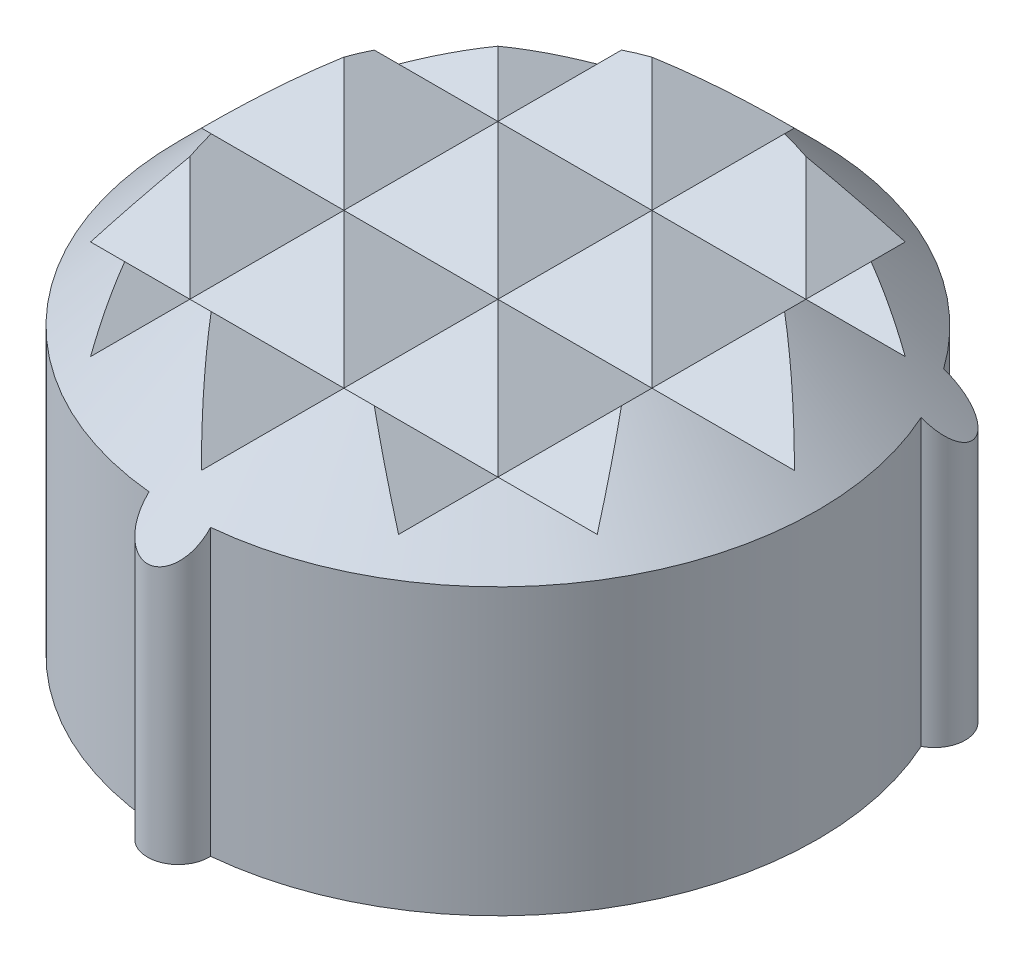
SolidWorks part; units mm, degrees
ref_plane "Front Plane" through (0, 0, 0) normal (0, 0, 1) x (1, 0, 0)
ref_plane "Top Plane" through (0, 0, 0) normal (0, 1, 0) x (1, 0, 0)
ref_plane "Right Plane" through (0, 0, 0) normal (1, 0, 0) x (0, 0, -1)
sketch "Sketch1" plane through (0, 0, 0) normal (0, 0, 1) x (1, 0, 0)
  line L0 (0, 0) -> (0, -66.2626) construction
  line L1 (0, 0) -> (4.55, 0)
  line L2 (4.55, 0) -> (4.55, 5)
  line L4 (4.55, 5) -> (0, 5)
  line L5 (0, 5) -> (0, 0)
  dimension "D1" = 5
  dimension "D2" = 9.1
revolve "Revolve1" add sketch "Sketch1" angle 360 about L0
sketch "Sketch2" plane through (0, 0, 0) normal (0, 1, 0) x (1, 0, 0)
  line L0 (0, 0) -> (0, -5.5148) construction
  line L1 (0, 0) -> (-5.4284, 3.1341) construction
  line L2 (0, 0) -> (5.592, 3.2286) construction
  arc A0 (0.3995, -4.1307) -> (3.7771, 1.7194) centre (0, 0) ccw
  circle A1 centre (0, 0) radius 5.05
  arc A3 (-0.3995, -4.1307) -> (0.3995, -4.1307) centre (0, -4.15) ccw
  arc A4 (-3.3775, 2.4114) -> (-3.7771, 1.7194) centre (-3.594, 2.075) ccw
  arc A5 (-3.7771, 1.7194) -> (-0.3995, -4.1307) centre (0, 0) ccw
  arc A6 (3.7771, 1.7194) -> (3.3775, 2.4114) centre (3.594, 2.075) ccw
  arc A7 (3.3775, 2.4114) -> (-3.3775, 2.4114) centre (0, 0) ccw
  circle A8 centre (0, 0) radius 4.55 construction
  dimension "D1" = 8.3
  dimension "D2" = 0.5
  dimension "D3" = 120
  dimension "D4" = 120
extrude "Extrude1" cut sketch "Sketch2" along normal through all
sketch "Sketch4" plane through (0, 0, 0) normal (0, 1, 0) x (1, 0, 0)
  line L0 (0, 0) -> (4.9919, 0) construction
  line L1 (0, 0) -> (3.8331, -3.8331) construction
  dimension "D1" = 45
ref_plane "Plane1" through (0, 0, 0) normal (0.7071, 0, 0.7071) x (0.7071, 0, -0.7071)
sketch "Sketch6" plane through (0, 0, 0) normal (1, 0, 0) x (0, 0, -1)
  line L0 (0, 0) -> (0, 4.8917) construction
  line L2 (-6.85, 1) -> (-6.85, 5)
  line L3 (-6.85, 5) -> (-2.85, 5)
  line L4 (-2.85, 5) -> (-6.85, 1)
  point P5 (-3.85, 4)
  dimension "D1" = 5
  dimension "D2" = 7.7
  dimension "D3" = 45
  dimension "D4" = 1
  dimension "D5" = 1
revolve "Cut-Revolve1" cut sketch "Sketch6" angle 360 about L0
sketch "Sketch5" plane through (0, 0, 0) normal (0, 0, 1) x (1, 0, 0)
  line L0 (1, 5) -> (0, 4)
  line L2 (0, 4) -> (-1, 5)
  line L3 (-1, 5) -> (1, 5)
  line L4 (0, 4) -> (0, 5) construction
  line L5 (-0.3995, 5) -> (-4.15, 5) construction
  dimension "D1" = 2
extrude "Extrude2" cut sketch "Sketch5" against normal through all and the other way through all
pattern_linear "LPattern1" count 8 spacing 2 along (-1, 0, 0) count 8 spacing 2 along (1, 0, 0) of "Extrude2"
mirror "Mirror1" about plane through (0, 0, 0) normal (0.7071, 0, 0.7071) of "LPattern1", "Extrude2"
sketch "Sketch7" [suppressed] plane through (0, 0, 0) normal (0, 1, 0) x (1, 0, 0)
  line L1 (-0.8, 0.8) -> (0.8, 0.8)
  line L2 (-0.8, 0.8) -> (-0.8, -0.8)
  line L3 (-0.8, -0.8) -> (0.8, -0.8)
  line L4 (0.8, 0.8) -> (0.8, -0.8)
  line L5 (-0.8, 0.8) -> (0.8, -0.8) construction
  line L6 (-0.8, -0.8) -> (0.8, 0.8) construction
  point P0 (0, 0)
  dimension "D1" = 1.6
extrude "Extrude3" [suppressed] add sketch "Sketch7" along normal blind 5.8
draft "Draft1" [suppressed] type of draft neutral plane draft angle 45 faces to draft 4 parameters "D1"=45
sketch "Sketch8" [suppressed] plane through (0, 0, 0) normal (0, 0, 1) x (1, 0, 0)
  line L0 (0, 0) -> (0, 4.8917) construction
  line L2 (-7.15, 1) -> (-7.15, 5)
  line L3 (-7.15, 5) -> (-3.15, 5)
  line L4 (-3.15, 5) -> (-7.15, 1)
  dimension "D1" = 5
  dimension "D2" = 7.7
  dimension "D3" = 45
  dimension "D4" = 1
revolve "Cut-Revolve3" [suppressed] cut sketch "Sketch8" angle 360 about L0
